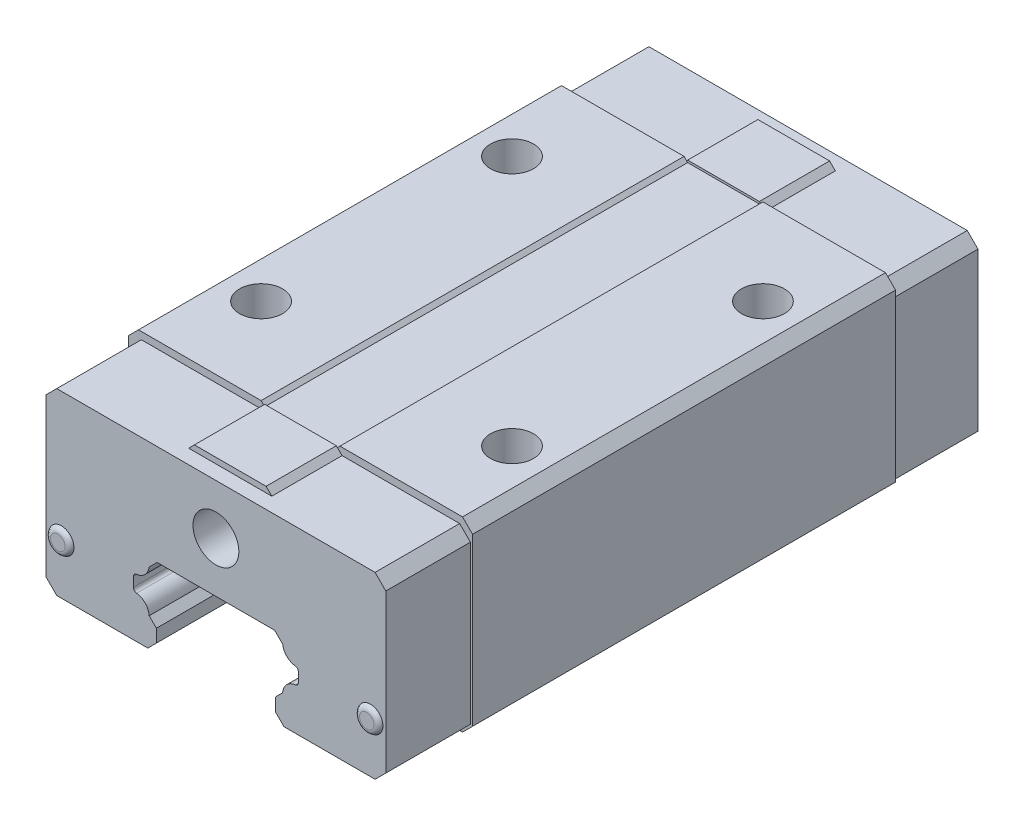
SolidWorks part; units mm, degrees
ref_plane "前视基准面" through (0, 0, 0) normal (0, 0, 1) x (1, 0, 0)
ref_plane "上视基准面" through (0, 0, 0) normal (0, 1, 0) x (1, 0, 0)
ref_plane "右视基准面" through (0, 0, 0) normal (1, 0, 0) x (0, 0, -1)
imported_body "输入1"
sketch "草图2" plane through (0, 0, 11.8) normal (0, 0, 1) x (1, 0, 0)
  line L0 (-10.2071, -11) -> (-22.2, -11) construction
  line L1 (-14, -11) -> (14, -11)
  line L2 (-14, -11) -> (-14, 3.3)
  line L3 (-14, 3.3) -> (14, 3.3)
  line L4 (14, -11) -> (14, 3.3)
  line L5 (11, 3.3) -> (-11, 3.3) construction
  line L6 (14, -6) -> (14, -2) construction
  line L7 (-14, -2) -> (-14, -6) construction
extrude "凸台-拉伸1" add sketch "草图2" against normal up to surface (82.6 mm away)
sketch "草图3" plane through (0, 0, 11.8) normal (0, 0, 1) x (1, 0, 0)
  line L0 (0, 0) -> (0, -18) construction
  line L1 (-22.6, 15) -> (22.6, 15) construction
  line L23 (11.5, -13) -> (8.3, -9.8)
  line L24 (8.3, -8) -> (9.305, -6.995)
  line L25 (9.3139, -1.1179) -> (8.196, 0)
  line L26 (-11.5, -13) -> (-11.5, -16.8)
  line L27 (-11.5, -16.8) -> (-10.3, -18)
  line L28 (-3, -18) -> (-2.5, -17.5)
  line L29 (-2.5, -17.5) -> (2.5, -17.5)
  line L30 (-8.3, -8) -> (-8.3, -9.8)
  line L31 (-8.3, -9.8) -> (-11.5, -13)
  line L32 (-3, -18) -> (3, -18) construction
  line L33 (3, -18) -> (10.3, -18)
  line L34 (11.5, -16.8) -> (11.5, -13)
  line L35 (10.3, -18) -> (11.5, -16.8)
  line L36 (2.5, -17.5) -> (3, -18)
  line L37 (-11.5, -3.3646) -> (-11.5, -4.654)
  line L38 (8.3, -9.8) -> (8.3, -8)
  line L39 (8.196, 0) -> (-8.196, 0)
  line L40 (-8.196, 0) -> (-9.3139, -1.1179)
  line L41 (-9.305, -6.995) -> (-8.3, -8)
  line L42 (-10.3, -18) -> (-3, -18)
  line L43 (11.5, -4.654) -> (11.5, -3.3646)
  arc A8 (11.5, -3.3646) -> (11.06, -2.8682) centre (11, -3.3646) ccw
  arc A9 (11.06, -5.1504) -> (11.5, -4.654) centre (11, -4.654) ccw
  arc A10 (-9.305, -6.995) -> (-11.06, -5.1504) centre (-11.3, -7.136) ccw
  arc A11 (-11.06, -2.8682) -> (-9.3139, -1.1179) centre (-11.3, -0.8827) ccw
  arc A12 (9.3139, -1.1179) -> (11.06, -2.8682) centre (11.3, -0.8827) ccw
  arc A13 (-11.06, -2.8682) -> (-11.5, -3.3646) centre (-11, -3.3646) ccw
  arc A14 (-11.5, -4.654) -> (-11.06, -5.1504) centre (-11, -4.654) ccw
  arc A15 (11.06, -5.1504) -> (9.305, -6.995) centre (11.3, -7.136) ccw
  dimension "D1" = 33
extrude "切除-拉伸2" cut sketch "草图3" against normal through all
sketch "草图5" plane through (0, 0, -68.8) normal (0, 0, -1) x (-1, 0, 0)
  line L0 (23.7, -9.5) -> (23.7, -11) construction
  line L1 (23.7, -9.5) -> (23.7, -11)
  line L2 (23.7, -9.5) -> (22.2, -11) construction
  line L3 (23.7, -11) -> (22.2, -11) construction
  line L4 (23.7, -9.5) -> (22.2, -11)
  line L5 (23.7, -11) -> (22.2, -11)
extrude "切除-拉伸3" cut sketch "草图5" against normal up to surface (9.8 mm away)
sketch "草图6" plane through (0, 0, -68.8) normal (0, 0, -1) x (-1, 0, 0)
  line L0 (-22.2, -11) -> (-23.7, -11) construction
  line L1 (-23.7, -11) -> (-23.7, -9.5) construction
  line L2 (-22.2, -11) -> (-23.7, -9.5) construction
  line L3 (-22.2, -11) -> (-23.7, -11)
  line L4 (-23.7, -11) -> (-23.7, -9.5)
  line L5 (-22.2, -11) -> (-23.7, -9.5)
extrude "切除-拉伸4" cut sketch "草图6" against normal up to surface (9.8 mm away)
sketch "草图7" plane through (0, 0, 0) normal (0, 0, 1) x (1, 0, 0)
  line L0 (-24, 5.6) -> (-23.7, 5.3) construction
  line L1 (-23.7, -9.9) -> (-23.71, -9.9)
  line L2 (-23.7, -9.9) -> (-23.7, 5.31)
  line L3 (-23.7, 5.31) -> (-23.71, 5.31)
  line L4 (-23.71, -9.9) -> (-23.71, 5.31)
  dimension "D1" = 0.01
extrude "凸台-拉伸2" add sketch "草图7" against normal up to surface (59 mm away)
sketch "草图8" plane through (0, 0, 0) normal (0, 0, 1) x (1, 0, 0)
  line L0 (0, 0) -> (0, 15) construction
  line L1 (-22.6, 15) -> (22.6, 15) construction
  line L3 (-5, 15) -> (5, 15)
  line L4 (-5, 15) -> (-5, 14.5)
  line L5 (-5, 14.5) -> (5, 14.5)
  line L6 (5, 15) -> (5, 14.5)
  dimension "D1" = 0.5
extrude "切除-拉伸5" cut sketch "草图8" against normal up to surface (59 mm away)
chamfer "倒角2" distance 0.5 angle 45 2 edges at (5, 15, -29.5) (-5, 15, -29.5)
